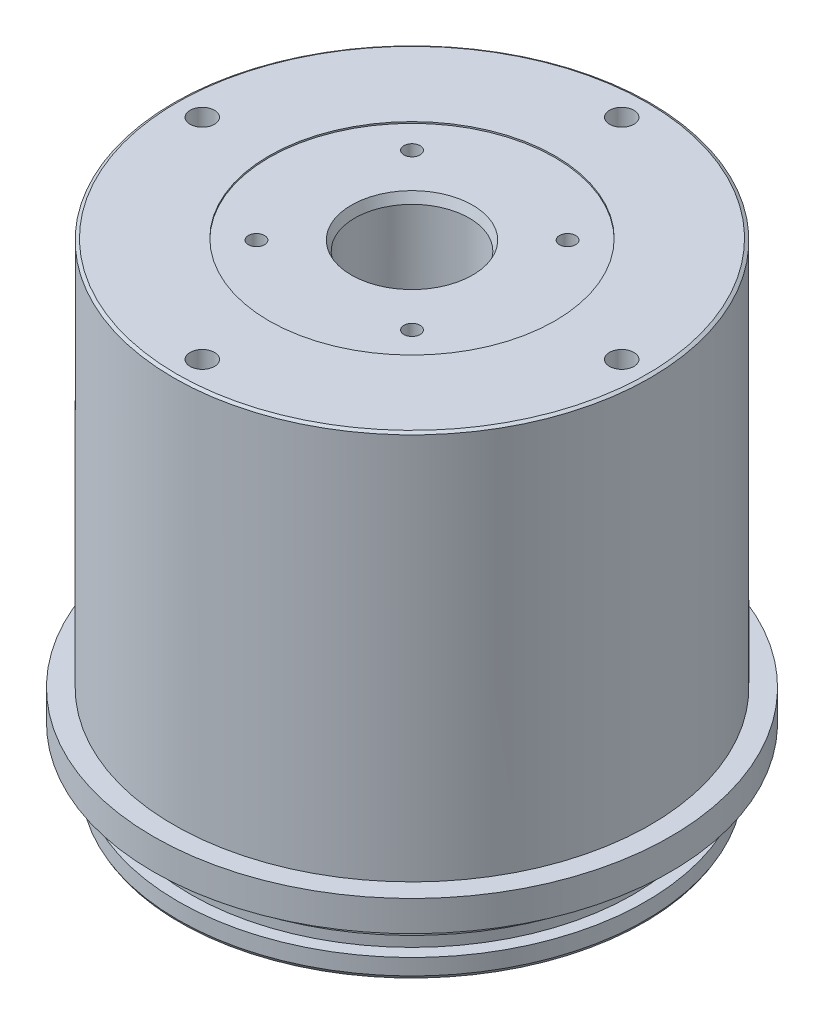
SolidWorks part; units mm, degrees
ref_plane "Front Plane" through (0, 0, 0) normal (0, 0, 1) x (1, 0, 0)
ref_plane "Top Plane" through (0, 0, 0) normal (0, 1, 0) x (1, 0, 0)
ref_plane "Right Plane" through (0, 0, 0) normal (1, 0, 0) x (0, 0, -1)
sketch "Sketch1" plane through (0, 0, 0) normal (0, 0, 1) x (1, 0, 0)
  line L0 (0, 0) -> (0, 101.6) construction
  line L1 (0, 0) -> (38.9255, 0)
  line L2 (38.9255, 0) -> (38.9255, 3.175)
  line L3 (38.9255, 3.175) -> (36.8681, 3.175)
  line L4 (36.8681, 3.175) -> (36.8681, 6.35)
  line L5 (38.9255, 6.35) -> (38.9255, 9.525)
  line L6 (36.8681, 6.35) -> (38.9255, 6.35)
  line L7 (38.9255, 9.525) -> (40.005, 9.525)
  line L8 (43.053, 9.525) -> (43.053, 14.605)
  line L9 (43.053, 14.605) -> (39.6748, 14.605)
  line L10 (39.6748, 14.605) -> (39.6748, 79.375)
  line L11 (39.6748, 79.375) -> (0, 79.375)
  line L12 (40.005, 9.525) -> (40.005, 10.668)
  line L13 (40.005, 10.668) -> (42.037, 10.668)
  line L14 (42.037, 10.668) -> (42.037, 9.525)
  line L15 (42.037, 9.525) -> (43.053, 9.525)
  line L16 (0, 0) -> (0, 79.375)
  dimension "D1" = 101.6
  dimension "D2" = 38.9255
  dimension "D3" = 3.175
  dimension "D4" = 36.8681
  dimension "D5" = 3.175
  dimension "D6" = 3.175
  dimension "D7" = 5.08
  dimension "D8" = 43.053
  dimension "D9" = 79.375
  dimension "D10" = 39.6748
  dimension "D11" = 40.005
  dimension "D12" = 2.032
  dimension "D13" = 1.143
revolve "Revolve1" add sketch "Sketch1" angle 360 about L0
sketch "Sketch2" plane through (0, 0, 0) normal (0, -1, 0) x (1, 0, 0)
  circle A0 centre (0, 0) radius 31.75
  dimension "D1" = 63.5
extrude "Cut-Extrude1" cut sketch "Sketch2" against normal blind 63.5
sketch "Sketch3" plane through (0, 79.375, 0) normal (0, 1, 0) x (1, 0, 0)
  circle A0 centre (0, 0) radius 9.525
  dimension "D1" = 19.05
extrude "Cut-Extrude2" cut sketch "Sketch3" against normal through all
sketch "Sketch4" plane through (0, 63.5, 0) normal (0, -1, 0) x (1, 0, 0)
  circle A0 centre (0, 25.4) radius 2.032
  dimension "D2" = 4.064
  dimension "D1" = 25.4
extrude "Cut-Extrude3" cut sketch "Sketch4" against normal blind 9.525
pattern_circular "CirPattern2" count 8 over 360 about axis through (0, 0, 0) along (0, 1, 0) of "Cut-Extrude3"
sketch "Sketch5" plane through (0, 79.375, 0) normal (0, 1, 0) x (1, 0, 0)
  circle A0 centre (0, 0) radius 23.8125
  dimension "D1" = 47.625
extrude "Cut-Extrude4" cut sketch "Sketch5" against normal blind 0.254
sketch "Sketch6" plane through (0, 79.121, 0) normal (0, 1, 0) x (1, 0, 0)
  circle A0 centre (12.954, 12.954) radius 1.3462
  circle A1 centre (-12.954, 12.954) radius 1.3462
  circle A2 centre (-12.954, -12.954) radius 1.3462
  circle A3 centre (12.954, -12.954) radius 1.3462
  dimension "D5" = 2.6924
  dimension "D6" = 2.6924
  dimension "D7" = 2.6924
  dimension "D8" = 2.6924
  dimension "D1" = 12.954
  dimension "D2" = 12.954
  dimension "D3" = 12.954
  dimension "D4" = 12.954
extrude "Cut-Extrude5" cut sketch "Sketch6" against normal blind 9.525
chamfer "Chamfer2" distance 0.508 angle 30 1 edges at (0, 0, -38.9255)
chamfer "Chamfer3" distance 1.5748 angle 20 1 edges at (0, 79.121, 9.525)
sketch "Sketch8" plane through (0, 79.375, 0) normal (0, 1, 0) x (1, 0, 0)
  circle A0 centre (0, 34.925) radius 2.032
  circle A1 centre (-34.925, 0) radius 2.032
  circle A2 centre (34.925, 0) radius 2.032
  circle A3 centre (0, -34.925) radius 2.032
  dimension "D5" = 4.064
  dimension "D6" = 4.064
  dimension "D7" = 4.064
  dimension "D8" = 4.064
  dimension "D1" = 34.925
  dimension "D2" = 34.925
  dimension "D3" = 34.925
  dimension "D4" = 34.925
extrude "Cut-Extrude6" cut sketch "Sketch8" against normal blind 9.525
chamfer "Chamfer4" distance 0.508 angle 30 1 edges at (0, 79.375, -39.6748)
fillet "Fillet1" radius 1.27 1 edges at (0, 63.5, -31.75)
